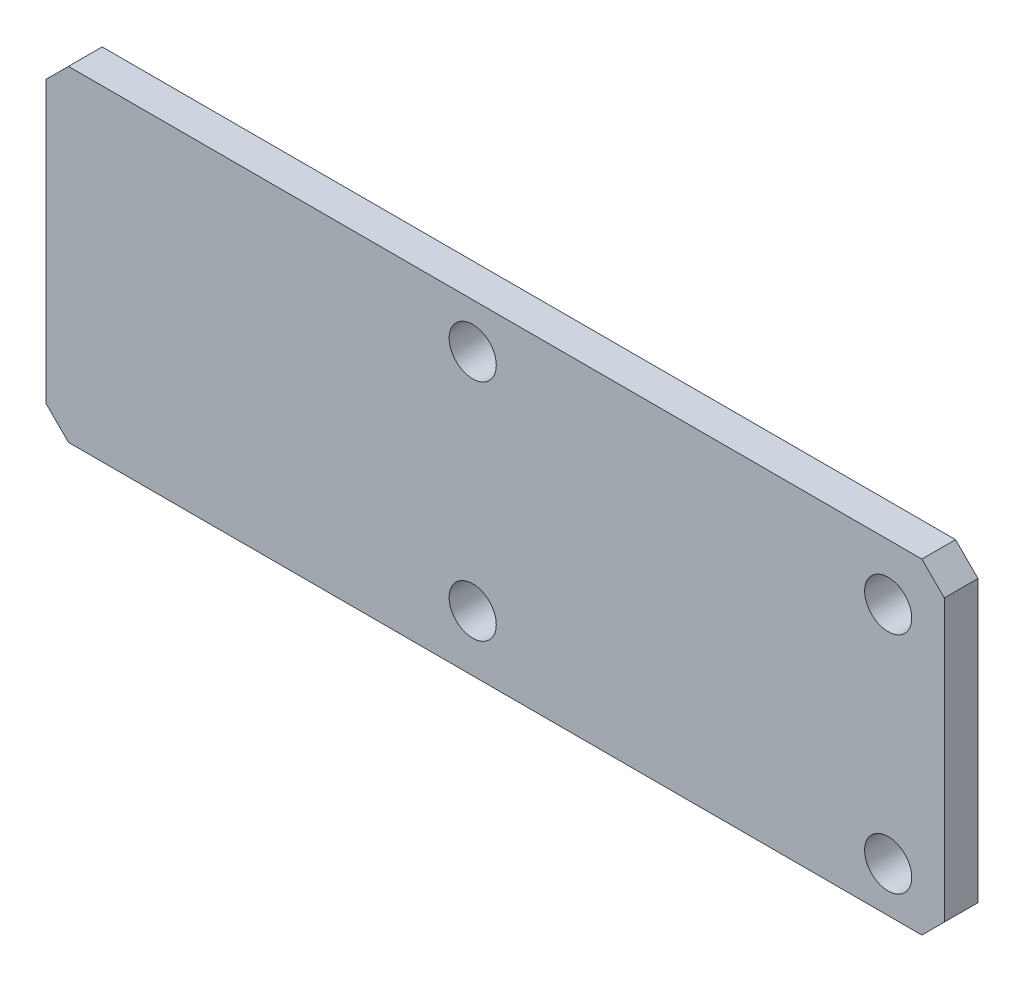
SolidWorks part; units mm, degrees
ref_plane "Plan de face" through (0, 0, 0) normal (0, 0, 1) x (1, 0, 0)
ref_plane "Plan de dessus" through (0, 0, 0) normal (0, 1, 0) x (1, 0, 0)
ref_plane "Plan de droite" through (0, 0, 0) normal (1, 0, 0) x (0, 0, -1)
sketch "Esquisse1" plane through (0, 0, 0) normal (0, 0, 1) x (1, 0, 0)
  line L1 (-30, 15) -> (50, 15)
  line L2 (-30, 15) -> (-30, -14)
  line L3 (-30, -14) -> (50, -14)
  line L4 (50, 15) -> (50, -14)
  circle A0 centre (45, 10) radius 2.1
  circle A1 centre (45, -10) radius 2.1
  circle A2 centre (8, 11) radius 2.1
  circle A3 centre (8, -9) radius 2.1
  dimension "D5" = 4.2
  dimension "D1" = 29
  dimension "D2" = 14
  dimension "D3" = 80
  dimension "D4" = 50
  dimension "D6" = 20
  dimension "D7" = 9
  dimension "D8" = 5
  dimension "D9" = 42
  dimension "D10" = 20
  dimension "D11" = 10
extrude "Extrusion1" add sketch "Esquisse1" along normal blind 3
chamfer "Chanfrein1" distance 2 angle 45 4 edges at (-30, -14, 1.5) (-30, 15, 1.5) (50, -14, 1.5) (50, 15, 1.5)
